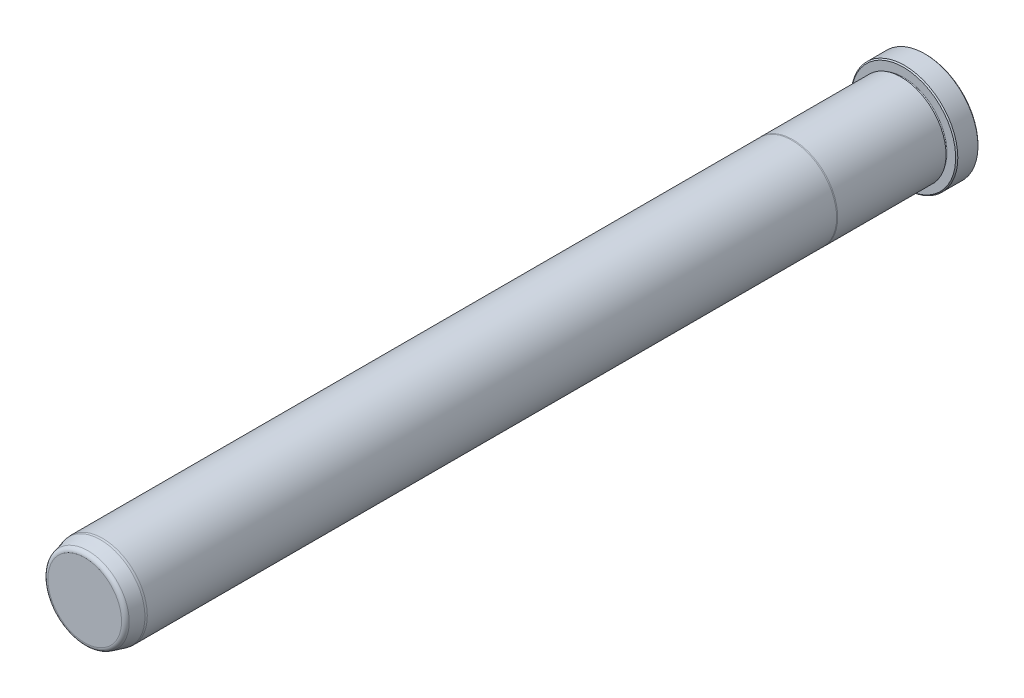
SolidWorks part; units mm, degrees
ref_plane "Front Plane" through (0, 0, 0) normal (0, 0, 1) x (1, 0, 0)
ref_plane "Top Plane" through (0, 0, 0) normal (0, 1, 0) x (1, 0, 0)
ref_plane "Right Plane" through (0, 0, 0) normal (1, 0, 0) x (0, 0, -1)
sketch "Sketch1" plane through (0, 0, 0) normal (1, 0, 0) x (0, 0, -1)
  line L0 (0, 0) -> (0, 18.923)
  line L1 (0, 18.923) -> (-7.9248, 18.923)
  line L2 (-7.9248, 18.923) -> (-7.9248, 15.4813)
  line L3 (-4.7498, 15.1003) -> (-5.5118, 15.1003) construction
  line L4 (-8.6868, 15.4813) -> (-8.6868, 15.8877)
  line L5 (-8.6868, 15.8877) -> (-47.1348, 15.8877)
  line L6 (-47.1348, 15.8877) -> (-47.498, 15.8623)
  line L7 (-47.498, 15.8623) -> (-292.1, 15.8623)
  line L9 (-298.45, 14.2983) -> (-298.45, 0)
  line L10 (-298.45, 0) -> (0, 0)
  line L11 (0, 0) -> (13.6287, 0) construction
  line L12 (-292.1, 15.8623) -> (-292.862, 15.7956)
  line L13 (-292.862, 15.7956) -> (-298.45, 14.2983)
  arc A0 (-8.6868, 15.4813) -> (-7.9248, 15.4813) centre (-8.3058, 15.4813) ccw
  dimension "D14" = 0.762
  dimension "D1" = 7.9248
  dimension "D2" = 0.762
  dimension "D3" = 37.846
  dimension "D4" = 31.7754
  dimension "D5" = 47.498
  dimension "D6" = 298.45
  dimension "D7" = 0.7874
  dimension "D8" = 4
  dimension "D9" = 31.7246
  dimension "D10" = 5
  dimension "D11" = 15
  dimension "D12" = 0.762
  dimension "D13" = 6.35
revolve "Revolve1" add sketch "Sketch1" angle 360 about L11
fillet "Fillet6" radius 1.5875 1 edges at (14.2983, 0, 298.45)
chamfer "Chamfer1" distance 0.381 angle 45 2 edges at (18.923, 0, 0) (18.923, 0, 7.9248)
